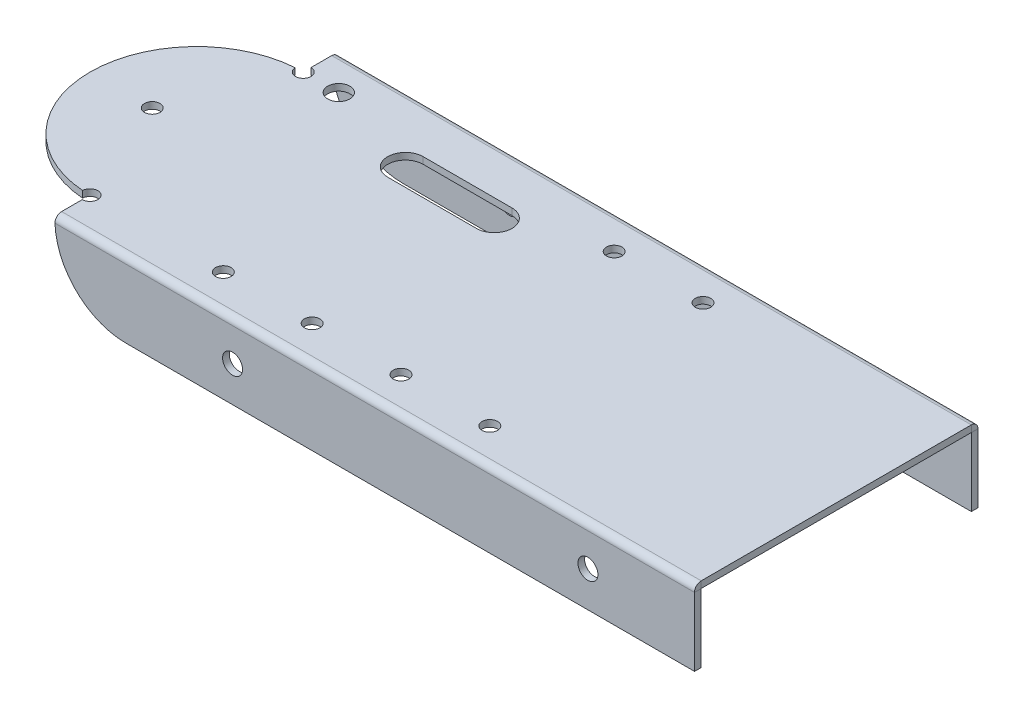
SolidWorks part; units mm, degrees
ref_plane "Front" through (0, 0, 0) normal (0, 0, 1) x (1, 0, 0)
ref_plane "Top" through (0, 0, 0) normal (0, 1, 0) x (1, 0, 0)
ref_plane "Right" through (0, 0, 0) normal (1, 0, 0) x (0, 0, -1)
sketch "Sketch1" plane through (0, 0, 0) normal (0, 1, 0) x (1, 0, 0)
  line L0 (54, 21) -> (74, 21)
  line L1 (168, -47) -> (168, 47)
  line L2 (24, 31) -> (24, 25.75)
  line L3 (40, -47) -> (168, -47)
  line L4 (24, -31) -> (24, -25.75)
  line L5 (74, 13) -> (54, 13)
  line L12 (40, 47) -> (168, 47)
  circle A0 centre (144, 39) radius 2.25
  arc A1 (40, 47) -> (24, 31) centre (40, 31) ccw
  circle A2 centre (114, 24) radius 1.75
  arc A3 (22.2512, 23.9362) -> (22.2512, -23.9362) centre (24, 0) ccw
  circle A4 centre (94, 24) radius 1.75
  circle A5 centre (64, 39) radius 2.25
  arc A6 (22.2512, 23.9362) -> (24, 25.75) centre (24, 24) ccw
  circle A7 centre (14, 0) radius 1.75
  arc A8 (22.2512, -23.9362) -> (24, -25.75) centre (24, -24) cw
  circle A9 centre (64, -39) radius 2.25
  circle A10 centre (94, -24) radius 1.75
  circle A11 centre (114, -24) radius 1.75
  arc A12 (40, -47) -> (24, -31) centre (40, -31) cw
  circle A13 centre (144, -39) radius 2.25
  circle A15 centre (32, 24) radius 2.5
  circle A16 centre (74, -24) radius 1.75
  circle A17 centre (54, -24) radius 1.75
  arc A18 (54, 21) -> (54, 13) centre (54, 17) ccw
  arc A19 (74, 13) -> (74, 21) centre (74, 17) ccw
sheet metal parameters "Sheet-Metal1" thickness 1.5 parameters "D1"=0.01
base flange "Base-Flange1" sketch "Sketch1" thickness 1.5 reverse thickness direction yes parameters "D1"=0.01
sketch "Sketch3" plane through (0, 1.5, 0) normal (0, 1, 0) x (-1, 0, 0)
  line L2 (-168, -31) -> (-19.3875, -31)
  line L3 (-168, 31) -> (-18.5134, 31)
sketched bend "Sketched Bend1" parameters "D1"=0
bend "SketchBend1" bend radius 0.01 bend angle 90 parameters "D5"=1
bend "SketchBend2" bend radius 0 bend angle 90 parameters "D5"=2
flat pattern "Flat-Pattern1"
sketch "Bend-Lines1" plane through (0, 1.5, 0) normal (0, 1, 0) x (-1, 0, 0)
  line L0 (-24, 31) -> (-168, 31) construction
  line L1 (-24, -31) -> (-168, -31) construction
bend of the flat pattern "Flatten-<SketchBend1>1"
bend of the flat pattern "Flatten-<SketchBend2>1"
